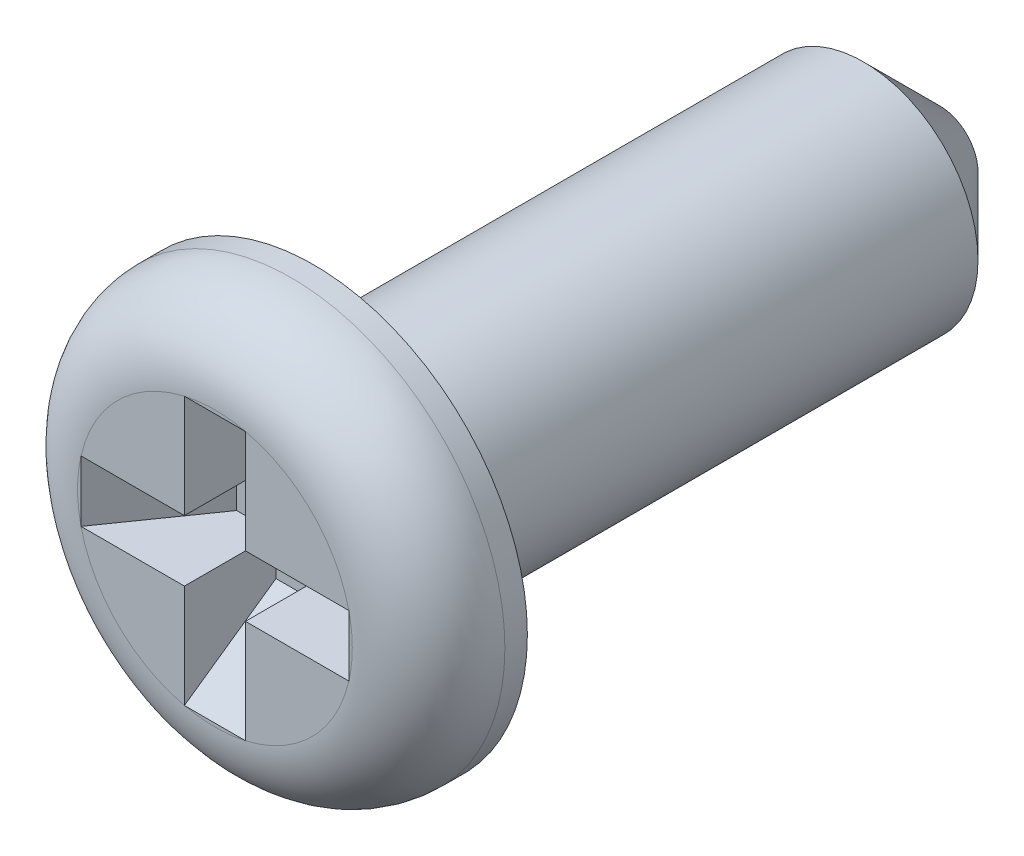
SolidWorks part; units mm, degrees
ref_plane "Plan de face" through (0, 0, 0) normal (0, 0, 1) x (1, 0, 0)
ref_plane "Plan de dessus" through (0, 0, 0) normal (0, 1, 0) x (1, 0, 0)
ref_plane "Plan de droite" through (0, 0, 0) normal (1, 0, 0) x (0, 0, -1)
sketch "Esquisse1" plane through (0, 0, 0) normal (1, 0, 0) x (0, 0, -1)
  line L0 (-1.6035, 0) -> (7.1529, 0) construction
  line L1 (0, 5.0438) -> (0, -4.594) construction
  line L2 (1.2947, 2.8) -> (1, 2.8)
  line L3 (1.2947, 2.8) -> (1.2947, 0)
  line L4 (-1.442, 2.8) -> (2.7621, 2.8) construction
  line L6 (-1.0988, 1.5) -> (4.1029, 1.5) construction
  line L7 (1.2947, 0) -> (0, 0)
  line L9 (0, 1.8) -> (0, 0)
  arc A0 (1, 2.8) -> (0, 1.8) centre (1, 1.8) ccw
  point P14 (0, 2.8)
  dimension "D1" = 1
revolve "Révolution2" add sketch "Esquisse1" angle 360 about L0
sketch "Esquisse3" plane through (0, 0, 0) normal (0, 0, 1) x (1, 0, 0)
  circle A0 centre (0, 0) radius 1.5
extrude "Extrusion1" add sketch "Esquisse3" against normal blind 9.5
sketch "Esquisse2" plane through (0, 0, 0) normal (0, 0, 1) x (1, 0, 0)
  line L0 (0.4, -0.4) -> (1.755, -0.4)
  line L1 (0.4, 0.4) -> (1.755, 0.4)
  line L2 (-1.755, -0.4) -> (-0.4, -0.4)
  line L3 (-0.4, 1.755) -> (-0.4, 0.4)
  line L4 (-1.755, 0.4) -> (-0.4, 0.4)
  line L5 (0.4, 1.755) -> (0.4, 0.4)
  line L6 (-0.4, 1.755) -> (0.4, 1.755)
  line L7 (1.755, 0.4) -> (1.755, -0.4)
  line L8 (0.4, -1.755) -> (-0.4, -1.755)
  line L9 (-1.755, -0.4) -> (-1.755, 0.4)
  line L10 (-0.4, -0.4) -> (-0.4, -1.755)
  line L12 (0.4, -0.4) -> (0.4, -1.755)
  circle A0 centre (0, 0) radius 1.8 construction
extrude "Enlèv. mat.-Extru.2" cut sketch "Esquisse2" against normal blind 1.2
draft "Dépouille3" type of draft neutral plane draft angle 35 faces to draft 4 parameters "D1"=35
chamfer "Chanfrein1" distance 1 angle 45 1 edges at (1.5, 0, -9.5)
